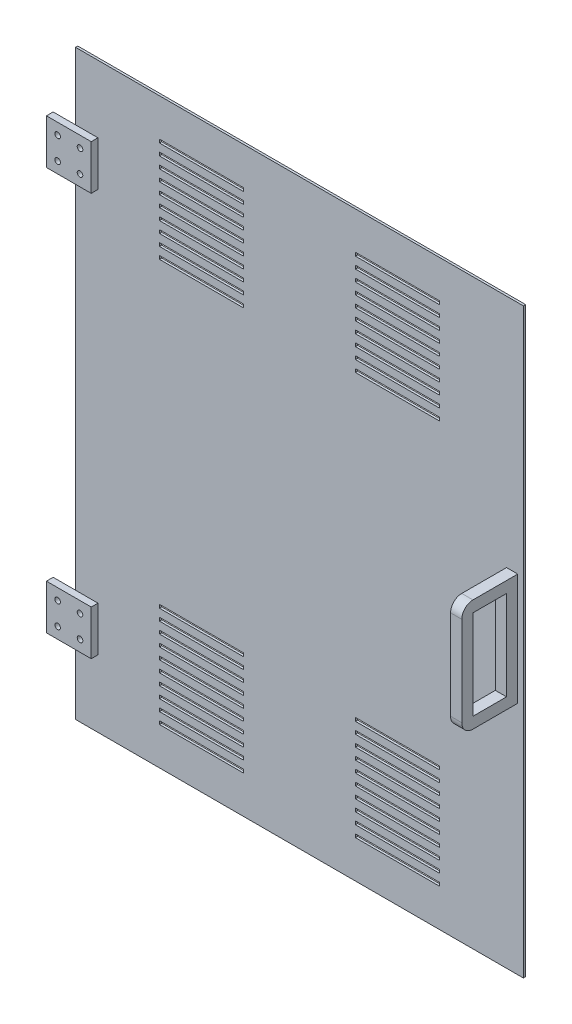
SolidWorks part; units mm, degrees
ref_plane "前视基准面" through (0, 0, 0) normal (0, 0, 1) x (1, 0, 0)
ref_plane "上视基准面" through (0, 0, 0) normal (0, 1, 0) x (1, 0, 0)
ref_plane "右视基准面" through (0, 0, 0) normal (1, 0, 0) x (0, 0, -1)
sketch "草图1" plane through (0, 0, 0) normal (0, 0, 1) x (1, 0, 0)
  line L0 (440, 40) -> (440, 560) construction
  line L1 (40, 560) -> (440, 560)
  line L2 (40, 560) -> (40, 40)
  line L3 (40, 40) -> (440, 40)
  line L4 (440, 560) -> (440, 40)
  line L5 (240, 560) -> (240, 40) construction
  line L6 (365, 523.4388) -> (290, 523.4388)
  line L7 (115, 526.4388) -> (190, 526.4388)
  line L8 (115, 526.4388) -> (115, 523.4388)
  line L9 (115, 523.4388) -> (190, 523.4388)
  line L10 (190, 526.4388) -> (190, 523.4388)
  line L11 (365, 526.4388) -> (290, 526.4388)
  line L12 (365, 526.4388) -> (365, 523.4388)
  line L13 (290, 526.4388) -> (290, 523.4388)
  line L14 (115, 516.4388) -> (190, 516.4388)
  line L15 (115, 513.4388) -> (190, 513.4388)
  line L16 (115, 516.4388) -> (115, 513.4388)
  line L17 (190, 516.4388) -> (190, 513.4388)
  line L18 (365, 516.4388) -> (365, 513.4388)
  line L19 (365, 516.4388) -> (290, 516.4388)
  line L20 (365, 513.4388) -> (290, 513.4388)
  line L21 (290, 516.4388) -> (290, 513.4388)
  line L22 (115, 506.4388) -> (190, 506.4388)
  line L23 (115, 503.4388) -> (190, 503.4388)
  line L24 (115, 506.4388) -> (115, 503.4388)
  line L25 (190, 506.4388) -> (190, 503.4388)
  line L26 (365, 506.4388) -> (365, 503.4388)
  line L27 (365, 506.4388) -> (290, 506.4388)
  line L28 (365, 503.4388) -> (290, 503.4388)
  line L29 (290, 506.4388) -> (290, 503.4388)
  line L30 (115, 496.4388) -> (190, 496.4388)
  line L31 (115, 493.4388) -> (190, 493.4388)
  line L32 (115, 496.4388) -> (115, 493.4388)
  line L33 (190, 496.4388) -> (190, 493.4388)
  line L34 (365, 496.4388) -> (365, 493.4388)
  line L35 (365, 496.4388) -> (290, 496.4388)
  line L36 (365, 493.4388) -> (290, 493.4388)
  line L37 (290, 496.4388) -> (290, 493.4388)
  line L38 (115, 486.4388) -> (190, 486.4388)
  line L39 (115, 483.4388) -> (190, 483.4388)
  line L40 (115, 486.4388) -> (115, 483.4388)
  line L41 (190, 486.4388) -> (190, 483.4388)
  line L42 (365, 486.4388) -> (365, 483.4388)
  line L43 (365, 486.4388) -> (290, 486.4388)
  line L44 (365, 483.4388) -> (290, 483.4388)
  line L45 (290, 486.4388) -> (290, 483.4388)
  line L46 (115, 476.4388) -> (190, 476.4388)
  line L47 (115, 473.4388) -> (190, 473.4388)
  line L48 (115, 476.4388) -> (115, 473.4388)
  line L49 (190, 476.4388) -> (190, 473.4388)
  line L50 (365, 476.4388) -> (365, 473.4388)
  line L51 (365, 476.4388) -> (290, 476.4388)
  line L52 (365, 473.4388) -> (290, 473.4388)
  line L53 (290, 476.4388) -> (290, 473.4388)
  line L54 (115, 466.4388) -> (190, 466.4388)
  line L55 (115, 463.4388) -> (190, 463.4388)
  line L56 (115, 466.4388) -> (115, 463.4388)
  line L57 (190, 466.4388) -> (190, 463.4388)
  line L58 (365, 466.4388) -> (365, 463.4388)
  line L59 (365, 466.4388) -> (290, 466.4388)
  line L60 (365, 463.4388) -> (290, 463.4388)
  line L61 (290, 466.4388) -> (290, 463.4388)
  line L62 (115, 456.4388) -> (190, 456.4388)
  line L63 (115, 453.4388) -> (190, 453.4388)
  line L64 (115, 456.4388) -> (115, 453.4388)
  line L65 (190, 456.4388) -> (190, 453.4388)
  line L66 (365, 456.4388) -> (365, 453.4388)
  line L67 (365, 456.4388) -> (290, 456.4388)
  line L68 (365, 453.4388) -> (290, 453.4388)
  line L69 (290, 456.4388) -> (290, 453.4388)
  line L70 (115, 446.4388) -> (190, 446.4388)
  line L71 (115, 443.4388) -> (190, 443.4388)
  line L72 (115, 446.4388) -> (115, 443.4388)
  line L73 (190, 446.4388) -> (190, 443.4388)
  line L74 (365, 446.4388) -> (365, 443.4388)
  line L75 (365, 446.4388) -> (290, 446.4388)
  line L76 (365, 443.4388) -> (290, 443.4388)
  line L77 (290, 446.4388) -> (290, 443.4388)
  line L78 (115, 436.4388) -> (190, 436.4388)
  line L79 (115, 433.4388) -> (190, 433.4388)
  line L80 (115, 436.4388) -> (115, 433.4388)
  line L81 (190, 436.4388) -> (190, 433.4388)
  line L82 (365, 436.4388) -> (365, 433.4388)
  line L83 (365, 436.4388) -> (290, 436.4388)
  line L84 (365, 433.4388) -> (290, 433.4388)
  line L85 (290, 436.4388) -> (290, 433.4388)
  line L86 (40, 300) -> (440, 300) construction
  line L87 (290, 163.5612) -> (290, 166.5612)
  line L88 (365, 166.5612) -> (290, 166.5612)
  line L89 (365, 163.5612) -> (290, 163.5612)
  line L90 (365, 163.5612) -> (365, 166.5612)
  line L91 (190, 163.5612) -> (190, 166.5612)
  line L92 (115, 163.5612) -> (115, 166.5612)
  line L93 (115, 166.5612) -> (190, 166.5612)
  line L94 (115, 163.5612) -> (190, 163.5612)
  line L95 (290, 153.5612) -> (290, 156.5612)
  line L96 (365, 156.5612) -> (290, 156.5612)
  line L97 (365, 153.5612) -> (290, 153.5612)
  line L98 (365, 153.5612) -> (365, 156.5612)
  line L99 (190, 153.5612) -> (190, 156.5612)
  line L100 (115, 153.5612) -> (115, 156.5612)
  line L101 (115, 156.5612) -> (190, 156.5612)
  line L102 (115, 153.5612) -> (190, 153.5612)
  line L103 (290, 143.5612) -> (290, 146.5612)
  line L104 (365, 146.5612) -> (290, 146.5612)
  line L105 (365, 143.5612) -> (290, 143.5612)
  line L106 (365, 143.5612) -> (365, 146.5612)
  line L107 (190, 143.5612) -> (190, 146.5612)
  line L108 (115, 143.5612) -> (115, 146.5612)
  line L109 (115, 146.5612) -> (190, 146.5612)
  line L110 (115, 143.5612) -> (190, 143.5612)
  line L111 (290, 133.5612) -> (290, 136.5612)
  line L112 (365, 136.5612) -> (290, 136.5612)
  line L113 (365, 133.5612) -> (290, 133.5612)
  line L114 (365, 133.5612) -> (365, 136.5612)
  line L115 (190, 133.5612) -> (190, 136.5612)
  line L116 (115, 133.5612) -> (115, 136.5612)
  line L117 (115, 136.5612) -> (190, 136.5612)
  line L118 (115, 133.5612) -> (190, 133.5612)
  line L119 (290, 123.5612) -> (290, 126.5612)
  line L120 (365, 126.5612) -> (290, 126.5612)
  line L121 (365, 123.5612) -> (290, 123.5612)
  line L122 (365, 123.5612) -> (365, 126.5612)
  line L123 (190, 123.5612) -> (190, 126.5612)
  line L124 (115, 123.5612) -> (115, 126.5612)
  line L125 (115, 126.5612) -> (190, 126.5612)
  line L126 (115, 123.5612) -> (190, 123.5612)
  line L127 (290, 113.5612) -> (290, 116.5612)
  line L128 (365, 116.5612) -> (290, 116.5612)
  line L129 (365, 113.5612) -> (290, 113.5612)
  line L130 (365, 113.5612) -> (365, 116.5612)
  line L131 (190, 113.5612) -> (190, 116.5612)
  line L132 (115, 113.5612) -> (115, 116.5612)
  line L133 (115, 116.5612) -> (190, 116.5612)
  line L134 (115, 113.5612) -> (190, 113.5612)
  line L135 (290, 103.5612) -> (290, 106.5612)
  line L136 (365, 106.5612) -> (290, 106.5612)
  line L137 (365, 103.5612) -> (290, 103.5612)
  line L138 (365, 103.5612) -> (365, 106.5612)
  line L139 (190, 103.5612) -> (190, 106.5612)
  line L140 (115, 103.5612) -> (115, 106.5612)
  line L141 (115, 106.5612) -> (190, 106.5612)
  line L142 (115, 103.5612) -> (190, 103.5612)
  line L143 (290, 93.5612) -> (290, 96.5612)
  line L144 (365, 96.5612) -> (290, 96.5612)
  line L145 (365, 93.5612) -> (290, 93.5612)
  line L146 (365, 93.5612) -> (365, 96.5612)
  line L147 (190, 93.5612) -> (190, 96.5612)
  line L148 (115, 93.5612) -> (115, 96.5612)
  line L149 (115, 96.5612) -> (190, 96.5612)
  line L150 (115, 93.5612) -> (190, 93.5612)
  line L151 (290, 83.5612) -> (290, 86.5612)
  line L152 (365, 86.5612) -> (290, 86.5612)
  line L153 (365, 83.5612) -> (290, 83.5612)
  line L154 (365, 83.5612) -> (365, 86.5612)
  line L155 (190, 83.5612) -> (190, 86.5612)
  line L156 (115, 83.5612) -> (115, 86.5612)
  line L157 (115, 86.5612) -> (190, 86.5612)
  line L158 (115, 83.5612) -> (190, 83.5612)
  line L159 (290, 73.5612) -> (290, 76.5612)
  line L160 (365, 73.5612) -> (365, 76.5612)
  line L161 (365, 73.5612) -> (290, 73.5612)
  line L162 (190, 73.5612) -> (190, 76.5612)
  line L163 (115, 76.5612) -> (190, 76.5612)
  line L164 (115, 73.5612) -> (115, 76.5612)
  line L165 (115, 73.5612) -> (190, 73.5612)
  line L166 (365, 76.5612) -> (290, 76.5612)
  dimension "D1" = 3
  dimension "D2" = 75
  dimension "D4" = 50
  dimension "D3" = 10
extrude "凸台-拉伸1" add sketch "草图1" against normal blind 2
sketch "草图3" plane through (0, 0, 0) normal (0, 0, 1) x (1, 0, 0)
  line L0 (40, 300) -> (440, 300) construction
  line L1 (20, 500) -> (60, 500)
  line L2 (20, 500) -> (20, 460)
  line L3 (20, 460) -> (60, 460)
  line L4 (60, 500) -> (60, 460)
  line L5 (40, 560) -> (40, 40) construction
  line L6 (440, 40) -> (440, 560) construction
  line L7 (24.427, 480) -> (60, 480) construction
  line L8 (30, 500) -> (30, 460) construction
  line L9 (50, 470) -> (50, 490) construction
  line L10 (50, 130) -> (50, 110) construction
  line L11 (30, 100) -> (30, 140) construction
  line L12 (24.427, 120) -> (60, 120) construction
  line L13 (60, 100) -> (60, 140)
  line L14 (20, 140) -> (60, 140)
  line L15 (20, 100) -> (20, 140)
  line L16 (20, 100) -> (60, 100)
  circle A0 centre (50, 490) radius 2.5
  circle A1 centre (50, 470) radius 2.5
  circle A2 centre (30, 490) radius 2.5
  circle A3 centre (30, 470) radius 2.5
  circle A4 centre (30, 130) radius 2.5
  circle A5 centre (30, 110) radius 2.5
  circle A6 centre (50, 130) radius 2.5
  circle A7 centre (50, 110) radius 2.5
  dimension "D5" = 5
  dimension "D6" = 5
  dimension "D8" = 10
  dimension "D12" = 5
  dimension "D13" = 5
  dimension "D1" = 40
  dimension "D2" = 20
  dimension "D3" = 40
  dimension "D4" = 160
  dimension "D7" = 10
  dimension "D9" = 10
  dimension "D10" = 10
  dimension "D11" = 10
extrude "凸台-拉伸2" add sketch "草图3" along normal blind 6
ref_plane "基准面1" through (425, 0, 0) normal (1, 0, 0) x (0, 0, -1)
sketch "草图4" plane through (425, 0, 0) normal (1, 0, 0) x (0, 0, -1)
  line L0 (0, 300) -> (-39.7978, 300) construction
  line L1 (0, 350) -> (-40, 350)
  line L2 (0, 350) -> (0, 250)
  line L3 (0, 250) -> (-40, 250)
  line L4 (-50, 340) -> (-50, 260)
  line L5 (0, 40) -> (0, 560) construction
  line L6 (-40, 340) -> (-40, 260)
  line L7 (-10, 260) -> (-40, 260)
  line L8 (-10, 340) -> (-10, 260)
  line L9 (-10, 340) -> (-40, 340)
  arc A0 (-50, 260) -> (-40, 250) centre (-40, 260) ccw
  arc A1 (-50, 340) -> (-40, 350) centre (-40, 340) cw
  arc A2 (-40, 260) -> (-40, 260) centre (-40, 260) ccw
  arc A3 (-40, 340) -> (-40, 340) centre (-40, 340) cw
  point P11 (-50, 250)
  point P14 (-50, 350)
  dimension "D5" = 10
  dimension "D1" = 100
  dimension "D2" = 210
  dimension "D3" = 50
  dimension "D4" = 0
  dimension "D6" = 10
extrude "凸台-拉伸3" add sketch "草图4" along normal blind 10
